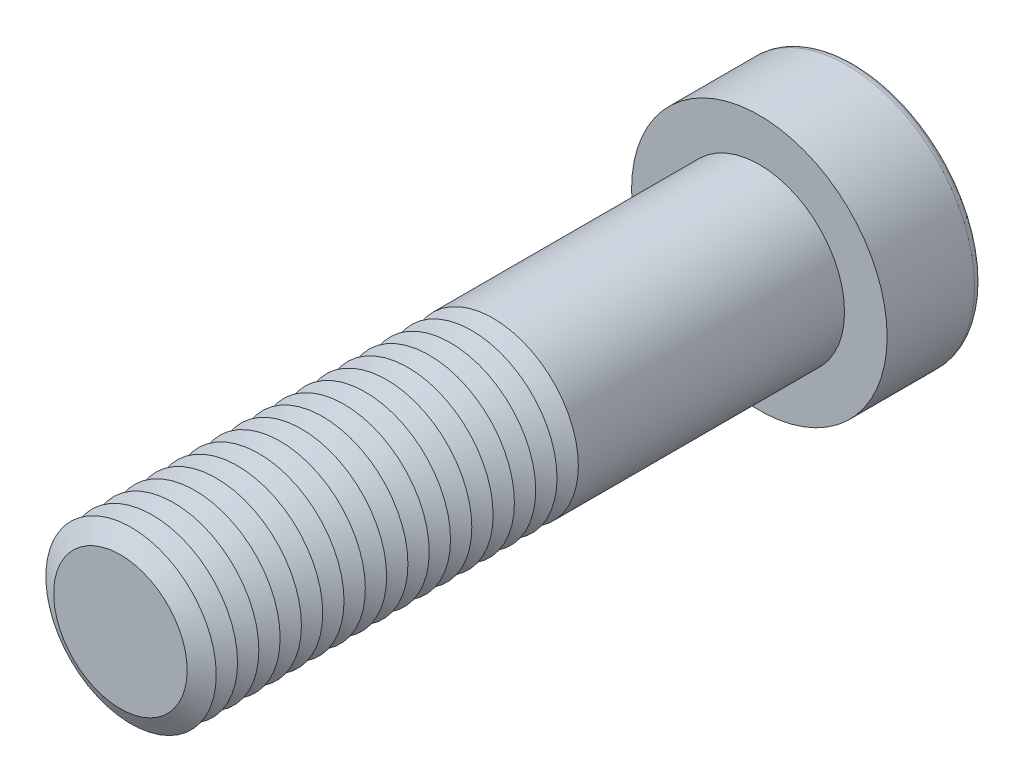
SolidWorks part; units mm, degrees
ref_plane "Front Plane" through (0, 0, 0) normal (0, 0, 1) x (1, 0, 0)
ref_plane "Top Plane" through (0, 0, 0) normal (0, 1, 0) x (1, 0, 0)
ref_plane "Right Plane" through (0, 0, 0) normal (1, 0, 0) x (0, 0, -1)
sketch "Sketch1" plane through (0, 0, 0) normal (0, 0, 1) x (1, 0, 0)
  circle A0 centre (0, 0) radius 8
  dimension "D1" = 16
extrude "Boss-Extrude1" add sketch "Sketch1" along normal blind 60
sketch "Sketch2" plane through (0, 0, 0) normal (0, 0, -1) x (-1, 0, 0)
  circle A0 centre (0, 0) radius 12
  dimension "D1" = 24
extrude "Boss-Extrude2" add sketch "Sketch2" along normal blind 9
sketch "Sketch3" plane through (0, 0, -9) normal (0, 0, -1) x (-1, 0, 0)
  line L1 (-3.4641, 6) -> (-6.9282, 0)
  line L2 (-6.9282, 0) -> (-3.4641, -6)
  line L3 (-3.4641, -6) -> (3.4641, -6)
  line L4 (3.4641, -6) -> (6.9282, 0)
  line L5 (6.9282, 0) -> (3.4641, 6)
  line L6 (3.4641, 6) -> (-3.4641, 6)
  circle A0 centre (0, 0) radius 6 construction
  dimension "D1" = 12
extrude "Cut-Extrude1" cut sketch "Sketch3" against normal blind 9
fillet "Fillet1" radius 0.8 1 edges at (-12, 0, -9)
sketch "Sketch4" plane through (0, 0, 0) normal (0, 0, -1) x (-1, 0, 0)
  line L0 (3.4641, -6) -> (6.9282, 0) construction
  circle A0 centre (0, 0) radius 6
extrude "Cut-Extrude2" cut sketch "Sketch4" against normal through all draft 60
sketch "Sketch5" plane through (0, 0, -9) normal (0, 0, -1) x (-1, 0, 0)
  circle A0 centre (0, 0) radius 6.9282
extrude "Cut-Extrude3" cut sketch "Sketch5" against normal through all draft 75
sketch "Sketch7" plane through (0, 0, 0) normal (1, 0, 0) x (0, 0, -1)
  line L25 (-60, 6.2679) -> (-59, 8)
  line L26 (-60, 8) -> (-60, -8) construction
  line L27 (-59, 8) -> (-61, 8)
  line L28 (-61, 8) -> (-60, 6.2679)
  line L29 (0, 8) -> (-60, 8) construction
  dimension "D1" = 2
revolve "Cut-Revolve1" cut sketch "Sketch7" angle 360 about axis through (0, 0, 60) along (0, 0, -1)
pattern_linear "LPattern1" count 18 spacing 2 along (0, 0, -1) of "Cut-Revolve1"
